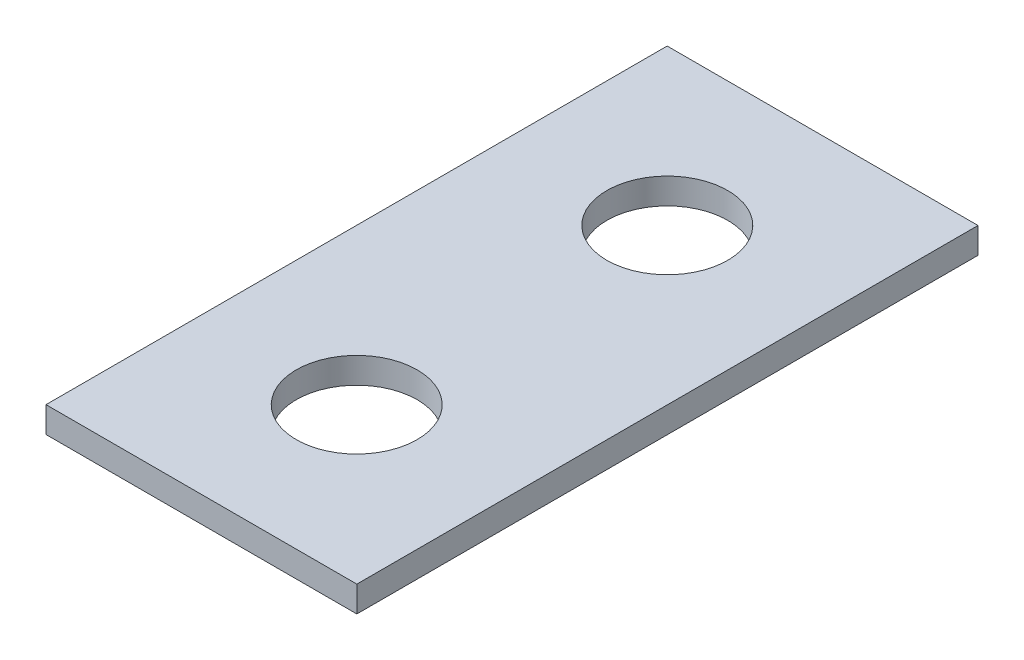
SolidWorks part; units mm, degrees
ref_plane "Front Plane" through (0, 0, 0) normal (0, 0, 1) x (1, 0, 0)
ref_plane "Top Plane" through (0, 0, 0) normal (0, 1, 0) x (1, 0, 0)
ref_plane "Right Plane" through (0, 0, 0) normal (1, 0, 0) x (0, 0, -1)
sketch "Sketch1" plane through (0, 0, 0) normal (0, 1, 0) x (1, 0, 0)
  line L1 (-4.7663, -9.525) -> (4.7663, -9.525)
  line L2 (-4.7663, -9.525) -> (-4.7663, 9.525)
  line L3 (-4.7663, 9.525) -> (4.7663, 9.525)
  line L4 (4.7663, -9.525) -> (4.7663, 9.525)
  line L5 (-4.7663, -9.525) -> (4.7663, 9.525) construction
  line L6 (-4.7663, 9.525) -> (4.7663, -9.525) construction
  point P0 (0, 0)
  dimension "D1" = 19.05
  dimension "D2" = 9.5326
extrude "Boss-Extrude1" add sketch "Sketch1" along normal blind 0.7937
sketch "Sketch2" plane through (0, 0.7937, 0) normal (0, 1, 0) x (1, 0, 0)
  line L0 (0, 0) -> (0, 15.3123) construction
  line L1 (0, 0) -> (-18.395, 0) construction
  circle A0 centre (0, 4.7625) radius 1.8542
  circle A1 centre (0, -4.7625) radius 1.8542
  dimension "D1" = 3.7084
  dimension "D2" = 9.525
extrude "Cut-Extrude1" cut sketch "Sketch2" against normal through all
